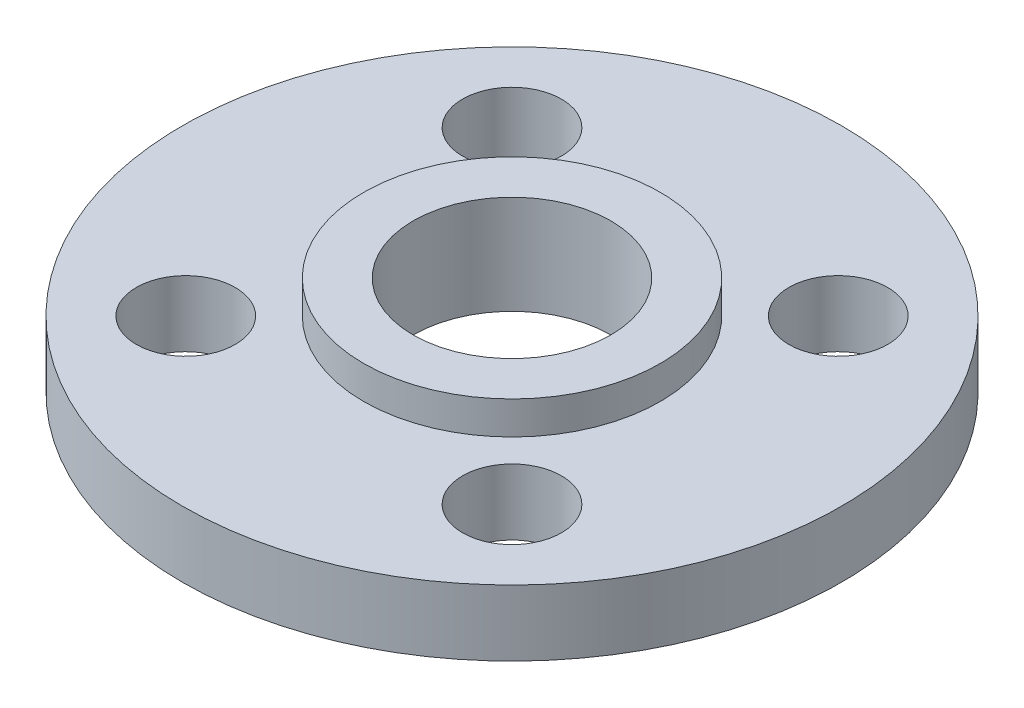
SolidWorks part; units mm, degrees
ref_plane "Front Plane" through (0, 0, 0) normal (0, 0, 1) x (1, 0, 0)
ref_plane "Top Plane" through (0, 0, 0) normal (0, 1, 0) x (1, 0, 0)
ref_plane "Right Plane" through (0, 0, 0) normal (1, 0, 0) x (0, 0, -1)
sketch "Sketch1" plane through (0, 0, 0) normal (0, 1, 0) x (1, 0, 0)
  line L1 (-4.9497, -4.9497) -> (4.9497, -4.9497) construction
  line L2 (-4.9497, -4.9497) -> (-4.9497, 4.9497) construction
  line L3 (-4.9497, 4.9497) -> (4.9497, 4.9497) construction
  line L4 (4.9497, -4.9497) -> (4.9497, 4.9497) construction
  line L5 (-4.9497, -4.9497) -> (4.9497, 4.9497) construction
  line L6 (-4.9497, 4.9497) -> (4.9497, -4.9497) construction
  circle A0 centre (0, 0) radius 10
  circle A1 centre (0, 0) radius 7 construction
  circle A2 centre (4.9497, 4.9497) radius 1.5
  circle A3 centre (4.9497, -4.9497) radius 1.5
  circle A4 centre (-4.9497, -4.9497) radius 1.5
  circle A5 centre (-4.9497, 4.9497) radius 1.5
  circle A6 centre (0, 0) radius 3
  dimension "D1" = 20
  dimension "D2" = 14
  dimension "D3" = 3
  dimension "D4" = 6
extrude "Boss-Extrude1" add sketch "Sketch1" along normal blind 2
sketch "Sketch2" plane through (0, 2, 0) normal (0, 1, 0) x (1, 0, 0)
  circle A0 centre (0, 0) radius 3 construction
  circle A1 centre (0, 0) radius 3
  circle A2 centre (0, 0) radius 4.5
  dimension "D1" = 9
extrude "Boss-Extrude2" add sketch "Sketch2" along normal blind 1
